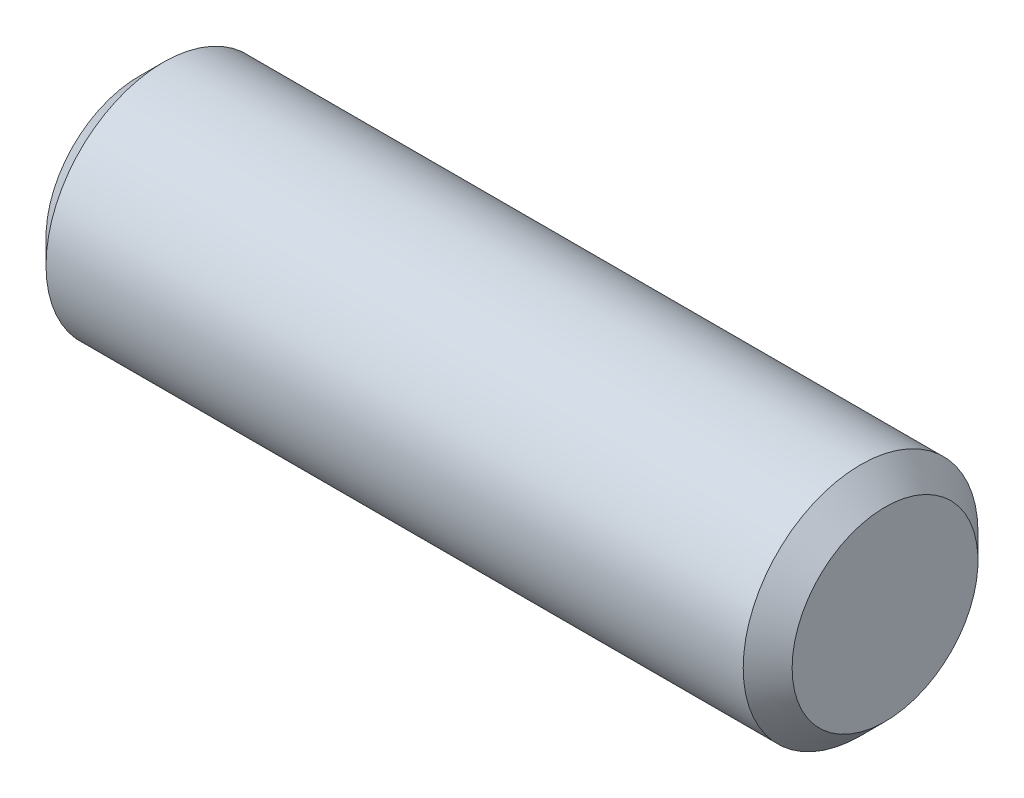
SolidWorks part; units mm, degrees
ref_plane "Front Plane" through (0, 0, 0) normal (0, 0, 1) x (1, 0, 0)
ref_plane "Top Plane" through (0, 0, 0) normal (0, 1, 0) x (1, 0, 0)
ref_plane "Right Plane" through (0, 0, 0) normal (1, 0, 0) x (0, 0, -1)
sketch "Sketch1" plane through (0, 0, 0) normal (0, 0, 1) x (1, 0, 0)
  line L0 (0, 0) -> (7.747, 0)
  line L1 (7.747, 0) -> (7.747, 1.219)
  line L2 (7.747, 1.219) -> (0, 1.219)
  line L3 (0, 1.219) -> (0, 0)
  dimension "D1" = 7.747
  dimension "D2" = 1.219
revolve "Revolve1" add sketch "Sketch1" angle 360 about L0
chamfer "Chamfer1" distance 0.254 angle 45 2 edges at (7.747, 0, 1.219) (0, 0, 1.219)
